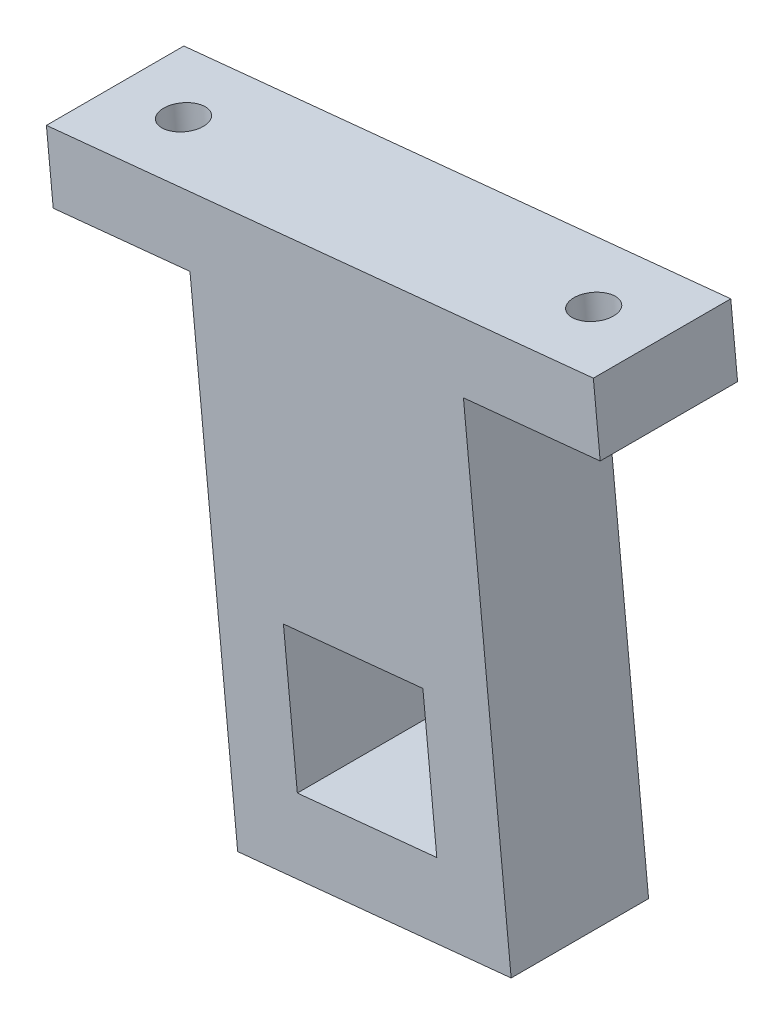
SolidWorks part; units mm, degrees
ref_plane "Front Plane" through (0, 0, 0) normal (0, 0, 1) x (1, 0, 0)
ref_plane "Top Plane" through (0, 0, 0) normal (0, 1, 0) x (1, 0, 0)
ref_plane "Right Plane" through (0, 0, 0) normal (1, 0, 0) x (0, 0, -1)
sketch "Sketch1" plane through (0, 0, 0) normal (0, 0, 1) x (1, 0, 0)
  line L0 (99.0673, -207.602) -> (90.7082, -123.7833) construction
  line L1 (102.8926, -194.5671) -> (101.8804, -184.4175)
  line L5 (92.743, -195.5793) -> (102.8926, -194.5671)
  line L6 (114.2855, -158.6593) -> (114.7817, -163.6346)
  line L7 (114.7817, -163.6346) -> (104.8311, -164.627)
  line L8 (104.8311, -164.627) -> (108.3043, -199.4542)
  line L9 (108.3043, -199.4542) -> (88.403, -201.4389)
  line L10 (84.9298, -166.6117) -> (88.403, -201.4389)
  line L11 (74.9791, -167.604) -> (84.9298, -166.6117)
  line L12 (74.483, -162.6287) -> (74.9791, -167.604)
  line L13 (92.743, -195.5793) -> (91.7308, -185.4297)
  line L16 (114.2855, -158.6593) -> (74.483, -162.6287)
  line L17 (101.8804, -184.4175) -> (91.7308, -185.4297)
  line L18 (92.2369, -190.5045) -> (109.4963, -188.7833) construction
  point P19 (98.3537, -200.4466)
  dimension "D1" = 5
  dimension "D2" = 10.2
  dimension "D3" = 20
  dimension "D4" = 10.2
  dimension "D5" = 35
  dimension "D6" = 5.4
extrude "Boss-Extrude1" add sketch "Sketch1" along normal blind 10
sketch "Sketch2" plane through (20.7618, -208.1846, 0) normal (0.0992, -0.9951, 0) x (-0.9951, -0.0992, 0)
  line L0 (-77.9768, 0) -> (-77.9768, -12.4483) construction
  line L1 (-67.9768, 0) -> (-87.9768, 0) construction
  line L2 (-57.9768, -5) -> (-105.9043, -5) construction
  line L3 (-57.9768, -10) -> (-57.9768, 0) construction
  line L4 (-62.9768, -10) -> (-62.9768, 2.653) construction
  line L5 (-57.9768, -10) -> (-67.9768, -10) construction
  line L6 (-92.9768, -10) -> (-92.9768, 2.0892) construction
  line L7 (-87.9768, -10) -> (-97.9768, -10) construction
hole_wizard "CSK for M2.5 Countersunk Flat Head Screw2" positions "Sketch9" profile "Sketch5" countersink size "M2.5" standard "ISO"
sketch "Sketch9" plane through (17.2885, -173.3574, 0) normal (0.0992, -0.9951, 0) x (-0.9951, -0.0992, 0)
  line L0 (-57.9768, -5) -> (-105.9043, -5) construction
  line L1 (-62.9768, -10) -> (-62.9768, 2.653) construction
  line L2 (-92.9768, -10) -> (-92.9768, 2.0892) construction
  point P0 (-62.9768, -5)
  point P6 (-92.9768, -5)
sketch "Sketch5" plane through (79.9545, -167.1079, 5) normal (0, 0, 1) x (0.9951, 0.0992, 0)
  line L0 (0, 0) -> (0, 8.9498)
  line L1 (0, 8.9498) -> (1.45, 8.9498)
  line L2 (1.45, 8.9498) -> (1.45, 1.3)
  line L3 (1.45, 1.3) -> (2.75, 0)
  line L5 (2.75, 0) -> (0, 0)
  line L6 (-1.45, 1.3) -> (-2.75, 0) construction
  line L11 (0, -6.35) -> (0, 107.95) construction
  dimension "Thru Hole Dia." = 2.9
  dimension "Thru Hole Depth" = 8.9498
  dimension "Near C'Sink Dia." = 5.5
  dimension "Near C'Sink Angle" = 90
